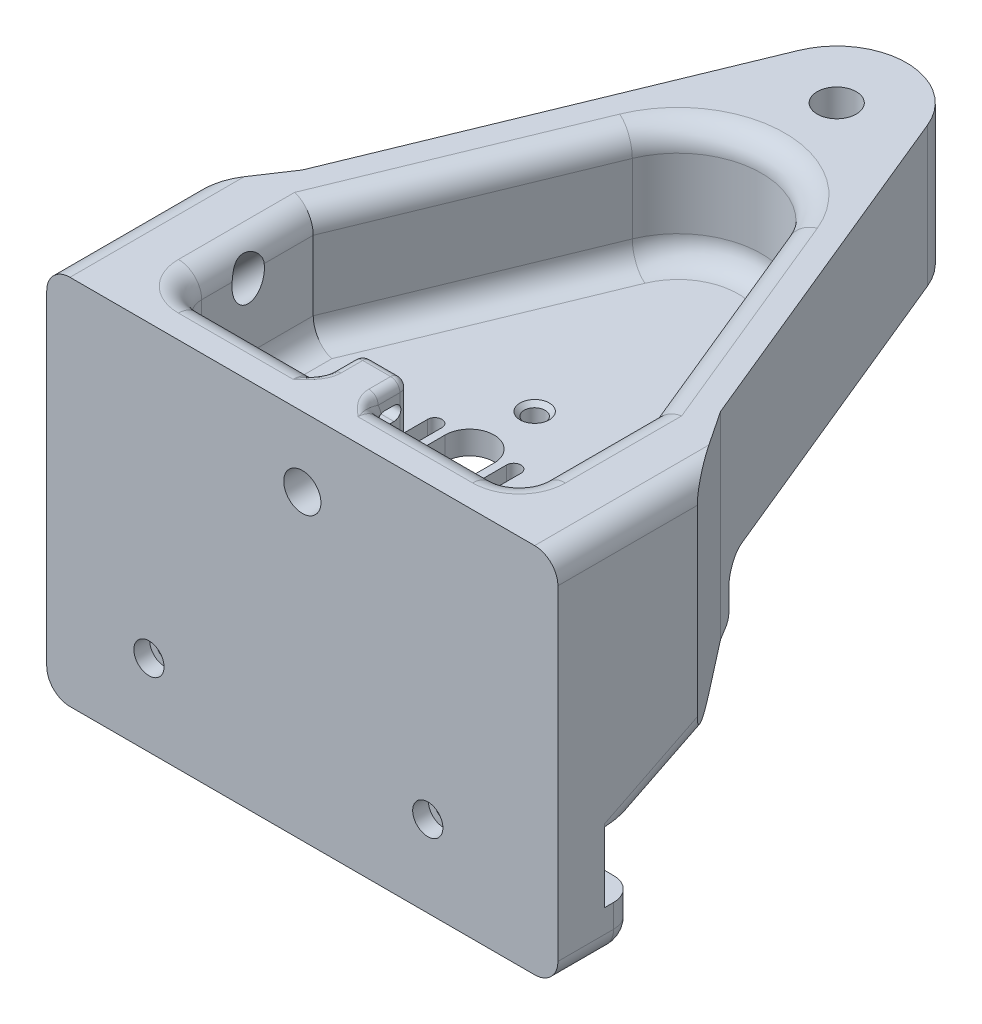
SolidWorks part; units mm, degrees
ref_plane "Alzado" through (0, 0, 0) normal (0, 0, 1) x (1, 0, 0)
ref_plane "Planta" through (0, 0, 0) normal (0, 1, 0) x (1, 0, 0)
ref_plane "Vista lateral" through (0, 0, 0) normal (1, 0, 0) x (0, 0, -1)
sketch "Croquis1" plane through (0, 0, 0) normal (0, 1, 0) x (1, 0, 0)
  line L0 (-55, -60) -> (-55, -50)
  line L1 (-55, -60) -> (55, -60)
  line L4 (-55, -50) -> (-45, -35)
  line L5 (-45, -35) -> (-13.8731, 40.7041)
  line L6 (13.8731, 40.7041) -> (45, -35)
  line L7 (55, -50) -> (45, -35)
  line L9 (55, -60) -> (55, -50)
  arc A0 (13.8731, 40.7041) -> (-13.8731, 40.7041) centre (0, 35) ccw
  dimension "D3" = 15
  dimension "D4" = 60
  dimension "D7" = 35
  dimension "D8" = 95
  dimension "D1" = 10
  dimension "D2" = 110
  dimension "D5" = 10
  dimension "D6" = 75.7041
  dimension "D9" = 15
  dimension "D10" = 25
  dimension "D11" = 55
  dimension "D12" = 81.8535
extrude "Saliente-Extruir1" add sketch "Croquis1" along normal blind 30
sketch "Croquis3" plane through (0, 30, 0) normal (0, 1, 0) x (1, 0, 0)
  line L5 (-36.6547, -41) -> (-16.6481, 7.6583)
  line L9 (-36.6547, -41) -> (-36.6547, -60)
  line L10 (-55, -60) -> (55, -60) construction
  line L11 (16.6473, 7.6583) -> (36.6539, -41)
  line L20 (36.6539, -41) -> (36.6539, -60)
  line L21 (36.6539, -60) -> (-36.6547, -60)
  line L22 (45, -35) -> (13.8731, 40.7041) construction
  line L27 (-13.8731, 40.7041) -> (-45, -35) construction
  arc A0 (16.6473, 7.6583) -> (-16.6481, 7.6583) centre (-0.0004, 0.8133) ccw
  dimension "D2" = 18
  dimension "D3" = 10
  dimension "D4" = 19
  dimension "D5" = 19
  dimension "D1" = 10.0007
extrude "Aligeramiento" cut sketch "Croquis3" against normal blind 25
sketch "Croquis4" plane through (0, 0, 0) normal (0, -1, 0) x (1, 0, 0)
  circle A0 centre (0, -35) radius 4.2
  arc A1 (-13.8731, -40.7041) -> (13.8731, -40.7041) centre (0, -35) ccw construction
  dimension "D1" = 8.4
extrude "Cortar-Extruir2" cut sketch "Croquis4" against normal up to next
ref_plane "Plano1" through (0, 0, 35) normal (0, 0, 1) x (1, 0, 0)
sketch "Croquis12" plane through (0, 5, 0) normal (0, 1, 0) x (1, 0, 0)
  line L0 (0, -44) -> (0, -50) construction
  line L1 (5.25, -44) -> (5.25, -50)
  line L2 (-5.25, -44) -> (-5.25, -50)
  line L3 (-8.5, -43) -> (-8.5, -53) construction
  line L4 (-6.95, -43) -> (-6.95, -53)
  line L5 (-10.05, -43) -> (-10.05, -53)
  line L6 (0, -50) -> (0, -34.0967) construction
  line L7 (8.5, -43) -> (8.5, -53) construction
  line L8 (6.95, -43) -> (6.95, -53)
  line L9 (10.05, -43) -> (10.05, -53)
  line L10 (-36.6547, -60) -> (36.6539, -60) construction
  arc A0 (5.25, -44) -> (-5.25, -44) centre (0, -44) ccw
  arc A1 (-5.25, -50) -> (5.25, -50) centre (0, -50) ccw
  arc A2 (-6.95, -43) -> (-10.05, -43) centre (-8.5, -43) ccw
  arc A3 (-10.05, -53) -> (-6.95, -53) centre (-8.5, -53) ccw
  arc A4 (6.95, -43) -> (10.05, -43) centre (8.5, -43) cw
  arc A5 (10.05, -53) -> (6.95, -53) centre (8.5, -53) cw
  point P2 (0, -47)
  point P6 (-8.5, -48)
  point P18 (8.5, -48)
  dimension "D3" = 5.25
  dimension "D4" = 17
  dimension "D8" = 10
  dimension "D1" = 10
  dimension "D2" = 6
  dimension "D5" = 44
  dimension "D6" = 7
  dimension "D7" = 3.1
  dimension "D9" = 3.1
extrude "Cortar-Extruir6" cut sketch "Croquis12" against normal blind 16
ref_plane "Plano2" through (15, 0, 0) normal (1, 0, 0) x (0, 0, -1)
ref_plane "Plano3" through (-15, 0, 0) normal (1, 0, 0) x (0, 0, -1)
sketch "Croquis21" plane through (0, 0, 0) normal (0, -1, 0) x (1, 0, 0)
  circle A0 centre (0, 30) radius 2.25
  circle A1 centre (0, -35) radius 4.2 construction
  dimension "D1" = 65
  dimension "D2" = 4.5
  dimension "D3" = 0
extrude "Cortar-Extruir10" cut sketch "Croquis21" against normal blind 10
fillet "Redondeo4" [suppressed] radius 10
sketch "Croquis23" plane through (0, 0, 60) normal (0, 0, 1) x (1, 0, 0)
  line L1 (55, 30) -> (-55, 30)
  line L2 (55, 30) -> (55, -50)
  line L3 (55, -50) -> (-55, -50)
  line L4 (-55, 30) -> (-55, -50)
  dimension "D1" = 80
  dimension "D2" = 110
extrude "Saliente-Extruir2" add sketch "Croquis23" along normal blind 20
sketch "Croquis24" plane through (0, 0, 0) normal (0, -1, 0) x (1, 0, 0)
  line L1 (-7.9674, -35) -> (-3.9837, -41.9)
  line L2 (-3.9837, -41.9) -> (3.9837, -41.9)
  line L3 (3.9837, -41.9) -> (7.9674, -35)
  line L4 (7.9674, -35) -> (3.9837, -28.1)
  line L5 (3.9837, -28.1) -> (-3.9837, -28.1)
  line L6 (-3.9837, -28.1) -> (-7.9674, -35)
  circle A0 centre (0, -35) radius 6.9 construction
  dimension "D1" = 13.8
extrude "Cortar-Extruir11" cut sketch "Croquis24" against normal blind 7
sketch "Croquis25" plane through (0, 30, 0) normal (0, 1, 0) x (1, 0, 0)
  line L1 (8.0829, 35) -> (4.0415, 42)
  line L2 (4.0415, 42) -> (-4.0415, 42)
  line L3 (-4.0415, 42) -> (-8.0829, 35)
  line L4 (-8.0829, 35) -> (-4.0415, 28)
  line L5 (-4.0415, 28) -> (4.0415, 28)
  line L6 (4.0415, 28) -> (8.0829, 35)
  circle A0 centre (0, 35) radius 7 construction
extrude "Cortar-Extruir12" [suppressed] cut sketch "Croquis25" against normal blind 6
sketch "Croquis27" plane through (0, 0, 0) normal (0, -1, 0) x (1, 0, 0)
  line L0 (-45, 35) -> (-55, 50)
  line L1 (-55, 50) -> (-55, 60)
  line L2 (-55, 60) -> (-30, 60)
  line L3 (45, 35) -> (43.7556, 31.9735)
  line L5 (55, 60) -> (30, 60)
  line L6 (-55, 60) -> (55, 60) construction
  line L7 (30, 39.162) -> (30, 60)
  line L8 (55, 60) -> (55, 50)
  line L9 (55, 50) -> (45, 35)
  line L10 (-45, 35) -> (-43.7556, 31.9735)
  line L13 (-30, 39.162) -> (-30, 60)
  arc A0 (43.7556, 31.9735) -> (30, 39.162) centre (0, -35) ccw
  arc A1 (-30, 39.162) -> (-43.7556, 31.9735) centre (0, -35) ccw
  dimension "D1" = 25
  dimension "D2" = 10
  dimension "D4" = 160
  dimension "D3" = 25
extrude "Saliente-Extruir3" add sketch "Croquis27" along normal blind 25
sketch "Croquis29" plane through (-55, 0, 0) normal (-1, 0, 0) x (0, 0, 1)
  line L0 (60, -25) -> (31.9735, -10.9867)
  line L2 (31.9735, -25) -> (31.9735, -10.9867)
  line L3 (31.9735, -25) -> (60, -25)
  dimension "D1" = 14.0133
extrude "Cortar-Extruir14" cut sketch "Croquis29" against normal through all
sketch "Croquis31" plane through (0, 0, 60) normal (0, 0, -1) x (-1, 0, 0)
  line L0 (-55, -25) -> (-30, -25) construction
  line L1 (-55, -25) -> (55, -25)
  line L2 (-55, -25) -> (-55, -40)
  line L3 (-55, -40) -> (55, -40)
  line L4 (55, -25) -> (55, -40)
  line L5 (55, -25) -> (55, -50) construction
  dimension "D1" = 110
  dimension "D2" = 15
extrude "Cortar-Extruir15" cut sketch "Croquis31" against normal blind 10
fillet "Redondeo5" radius 5 4 edges at (55, 30, 65) (-55, 30, 65) (55, -22.5, 55) (-55, -22.5, 55)
fillet "Redondeo7" radius 5 9 edges at (-37.0525, 0, 35.9021) (37.0525, 0, 35.9021) (30, -12.5, 60) (-30, -12.5, 60) (-30, 0, 49.581) (30, 0, 49.581) (30, -7.2905, 39.162) (-30, -7.2905, 39.162)
fillet "Redondeo9" [suppressed] radius 2
fillet "Redondeo10" radius 2 9 edges at (-38.4628, -12.5735, 35.1471) (-30.7992, -14.874, 39.748) (-30, -19.3649, 48.7298) (0, -25, 60) (28.5355, -24.2678, 58.5355) (30, -19.3649, 48.7298) (30.7992, -14.874, 39.748) (-28.5355, -24.2678, 58.5355) (38.4628, -12.5735, 35.1471)
sketch "Croquis32" plane through (0, 0, 60) normal (0, 0, -1) x (-1, 0, 0)
  line L1 (36.6547, 5) -> (-36.6539, 5)
  line L2 (36.6547, 5) -> (36.6547, 30)
  line L3 (36.6547, 30) -> (-36.6539, 30)
  line L4 (-36.6539, 5) -> (-36.6539, 30)
extrude "Cortar-Extruir16" cut sketch "Croquis32" against normal blind 10
hole_wizard "Refrentado para tornillo con cabeza plana de M51" positions "Croquis34" profile "Croquis33" counterbore size "M5" standard "ISO"
sketch "Croquis34" plane through (0, 5, 0) normal (0, 1, 0) x (1, 0, 0)
  point P0 (0, -30)
sketch "Croquis33" plane through (0, 5, 30) normal (1, 0, 0) x (0, 0, 1)
  line L0 (0, 0) -> (0, 55)
  line L1 (0, 55) -> (2.75, 55)
  line L3 (2.75, 55) -> (2.75, 1)
  line L4 (2.75, 1) -> (5, 1)
  line L5 (5, 1) -> (5, 0)
  line L7 (5, 0) -> (0, 0)
  line L11 (0, -6.35) -> (0, 31.3273) construction
  dimension "Diámetro de taladro hasta el siguiente" = 5.5
  dimension "Profundidad de taladro hasta el siguiente" = 55
  dimension "Diámetro de refrentado" = 10
  dimension "Profundidad de refrentado" = 1
hole_wizard "Avellanado para tornillo con cabeza plana avellanada de M31" positions "Croquis36" profile "Croquis35" countersink size "M3" standard "ISO"
sketch "Croquis36" plane through (0, 5, 0) normal (0, 1, 0) x (1, 0, 0)
  point P0 (0, -30)
sketch "Croquis35" plane through (0, 5, 30) normal (1, 0, 0) x (0, 0, 1)
  line L0 (0, 0) -> (0, 55)
  line L1 (0, 55) -> (1.7, 55)
  line L2 (1.7, 55) -> (1.7, 1.45)
  line L3 (1.7, 1.45) -> (3.15, 0)
  line L5 (3.15, 0) -> (0, 0)
  line L6 (-1.7, 1.45) -> (-3.15, 0) construction
  line L11 (0, -6.35) -> (0, 107.95) construction
  dimension "Diámetro de taladro hasta el siguiente" = 3.4
  dimension "Profundidad de taladro hasta el siguiente" = 55
  dimension "Diámetro de avellanado cercano" = 6.3
  dimension "Ángulo de avellanado cercano" = 90
sketch "Croquis44" plane through (0, 0, 70) normal (0, 0, -1) x (-1, 0, 0)
  line L0 (-36.6539, 5) -> (36.6547, 5) construction
  line L1 (-5, 5) -> (5, 5)
  line L2 (-5, 5) -> (-5, 30)
  line L3 (-5, 30) -> (5, 30)
  line L4 (5, 5) -> (5, 30)
  line L5 (36.6547, 30) -> (-36.6539, 30) construction
  line L7 (5.25, 5) -> (-5.25, 5) construction
  point P10 (0, 5)
  dimension "D1" = 25
  dimension "D2" = 10
  dimension "D3" = 5
extrude "Saliente-Extruir4" add sketch "Croquis44" along normal blind 8
hole_wizard "Refrentado para tornillo con cabeza plana de M42" positions "Croquis46" profile "Croquis45" counterbore size "M4" standard "ISO"
sketch "Croquis46" plane through (0, 0, 80) normal (0, 0, 1) x (1, 0, 0)
  line L0 (50, 30) -> (-50, 30) construction
  point P0 (0, 15)
  dimension "D1" = 15
sketch "Croquis45" plane through (0, 15, 80) normal (1, 0, 0) x (0, -1, 0)
  line L0 (0, 0) -> (0, 18)
  line L1 (0, 18) -> (2.25, 18)
  line L3 (2.25, 18) -> (2.25, 12)
  line L4 (2.25, 12) -> (4, 12)
  line L5 (4, 12) -> (4, 0)
  line L7 (4, 0) -> (0, 0)
  line L11 (0, -6.35) -> (0, 107.95) construction
  dimension "Diámetro de taladro hasta el siguiente" = 4.5
  dimension "Profundidad de taladro hasta el siguiente" = 18
  dimension "Diámetro de refrentado" = 8
  dimension "Profundidad de refrentado" = 12
sketch "Croquis47" plane through (0, 0, 62) normal (0, 0, -1) x (-1, 0, 0)
  line L1 (1.6454, 17.85) -> (-1.6454, 17.85)
  line L2 (-1.6454, 17.85) -> (-3.2909, 15)
  line L3 (-3.2909, 15) -> (-1.6454, 12.15)
  line L4 (-1.6454, 12.15) -> (1.6454, 12.15)
  line L5 (1.6454, 12.15) -> (3.2909, 15)
  line L6 (3.2909, 15) -> (1.6454, 17.85)
  line L7 (-5, 5) -> (5, 5) construction
  circle A0 centre (0, 15) radius 2.85 construction
  dimension "D1" = 5.7
  dimension "D2" = 0
extrude "Cortar-Extruir18" cut sketch "Croquis47" against normal blind 3
fillet "Redondeo11" radius 5 15 edges at (26.6506, 30, 16.6709) (-0.0004, 30, -18.8133) (26.6506, 5, 16.6709) (-0.0004, 5, -18.8133) (20.8269, 5, 70) (-20.8273, 5, 70) (-36.6547, 17.5, 70) (36.6539, 17.5, 70) (20.8269, 30, 70) (-20.8273, 30, 70) (-26.6514, 30, 16.6709) (-26.6514, 5, 16.6709) (-36.6547, 5, 55.5)
ref_plane "Plano4" through (-52.5, -52.5, 0) normal (0.7071, 0.7071, 0) x (0, 0, -1)
sketch "Croquis49" plane through (-52.5, -52.5, 0) normal (0.7071, 0.7071, 0) x (0, 0, -1)
  line L3 (-47.8033, 58.033) -> (-80, 58.033) construction
  line L4 (-35, 53.033) -> (-35, 22.981) construction
  circle A0 centre (-55, 43.033) radius 3.5
  dimension "D1" = 7
  dimension "D2" = 20
  dimension "D3" = 15
extrude "Cortar-Extruir19" cut sketch "Croquis49" along normal up to next
sketch "Croquis51" plane through (5, 0, 0) normal (1, 0, 0) x (0, 0, -1)
  line L0 (-65.2753, 24.7579) -> (-67.2753, 24.7579) construction
  line L1 (-65.2753, 23.2579) -> (-67.2753, 23.2579)
  line L2 (-65.2753, 26.2579) -> (-67.2753, 26.2579)
  line L4 (-62, 30) -> (-75, 30) construction
  arc A0 (-65.2753, 23.2579) -> (-65.2753, 26.2579) centre (-65.2753, 24.7579) ccw
  arc A1 (-67.2753, 26.2579) -> (-67.2753, 23.2579) centre (-67.2753, 24.7579) ccw
  point P2 (-66.2753, 24.7579)
  dimension "D2" = 3
  dimension "D1" = 2
  dimension "D3" = 0
extrude "Cortar-Extruir20" cut sketch "Croquis51" against normal blind 10
fillet "Redondeo13" radius 2 14 edges at (-5, 5, 63.5) (-5, 6.4645, 68.5355) (-5, 28.5355, 71.4645) (5, 28.5355, 71.4645) (5, 5, 63.5) (5, 6.4645, 68.5355) (-5, 17.5, 70) (-5, 17.5, 62) (5, 17.5, 62) (5, 17.5, 70) (0, 30, 62) (-5, 30, 68.5) (5, 30, 68.5) (0, 5, 62)
sketch "Croquis54" plane through (0, 0, 60) normal (0, 0, -1) x (-1, 0, 0)
  line L1 (-55, -40) -> (55, -40)
  line L2 (-55, -40) -> (-55, -50)
  line L3 (-55, -50) -> (55, -50)
  line L4 (55, -40) -> (55, -50)
extrude "Cortar-Extruir21" cut sketch "Croquis54" against normal blind 3
fillet "Redondeo14" radius 5 5 edges at (55, -50, 71.5) (55, -45, 63) (0, -50, 63) (-55, -50, 71.5) (-55, -45, 63)
hole_wizard "Refrentado para tornillo con cabeza hueca de M31" positions "Croquis60" profile "Croquis59" counterbore size "M3" standard "ISO"
sketch "Croquis60" plane through (0, 0, 80) normal (0, 0, 1) x (1, 0, 0)
  point P0 (27, -32.5)
  point P3 (-33, -32.5)
  dimension "D1" = 60
sketch "Croquis59" plane through (27, -32.5, 80) normal (1, 0, 0) x (0, -1, 0)
  line L0 (0, 0) -> (0, 130)
  line L1 (0, 130) -> (1.7, 130)
  line L3 (1.7, 130) -> (1.7, 3.4)
  line L4 (1.7, 3.4) -> (3.25, 3.4)
  line L5 (3.25, 3.4) -> (3.25, 0)
  line L7 (3.25, 0) -> (0, 0)
  line L11 (0, -6.35) -> (0, 107.95) construction
  dimension "Diámetro de taladro hasta el siguiente" = 3.4
  dimension "Profundidad de taladro hasta el siguiente" = 130
  dimension "Diámetro de refrentado" = 6.5
  dimension "Profundidad de refrentado" = 3.4
